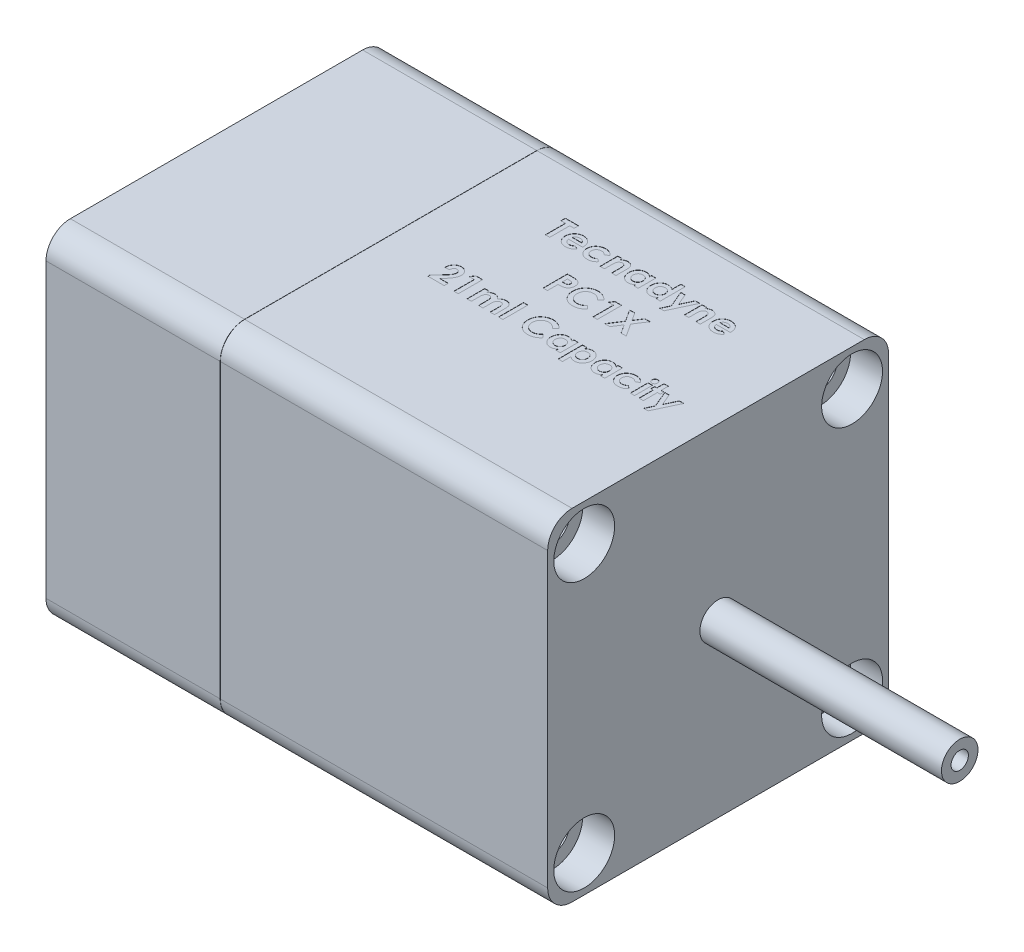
SolidWorks part; units mm, degrees
ref_plane "Front Plane" through (0, 0, 0) normal (0, 0, 1) x (1, 0, 0)
ref_plane "Top Plane" through (0, 0, 0) normal (0, 1, 0) x (1, 0, 0)
ref_plane "Right Plane" through (0, 0, 0) normal (1, 0, 0) x (0, 0, -1)
sketch "Sketch1" plane through (0, 0, 0) normal (1, 0, 0) x (0, 0, -1)
  line L1 (3.175, 0) -> (41.275, 0)
  line L2 (0, 3.175) -> (0, 41.275)
  line L3 (3.175, 44.45) -> (41.275, 44.45)
  line L4 (44.45, 3.175) -> (44.45, 41.275)
  arc A0 (3.175, 0) -> (0, 3.175) centre (3.175, 3.175) cw
  arc A1 (41.275, 0) -> (44.45, 3.175) centre (41.275, 3.175) ccw
  arc A2 (41.275, 44.45) -> (44.45, 41.275) centre (41.275, 41.275) cw
  arc A3 (0, 41.275) -> (3.175, 44.45) centre (3.175, 41.275) cw
  point P7 (0, 0)
  point P10 (44.45, 0)
  point P13 (44.45, 44.45)
  point P16 (0, 44.45)
  dimension "D3" = 3.175
  dimension "D1" = 44.45
  dimension "D2" = 44.45
extrude "Boss-Extrude1" add sketch "Sketch1" along normal blind 65.405
sketch "Sketch2" plane through (65.405, 0, 0) normal (1, 0, 0) x (0, 0, -1)
  circle A0 centre (22.225, 22.225) radius 2.3813
  dimension "D1" = 4.7625
extrude "Boss-Extrude2" add sketch "Sketch2" along normal blind 31.496
ref_plane "Plane1" through (22.733, 0, 0) normal (1, 0, 0) x (0, 0, -1)
sketch "Sketch3" plane through (22.733, 0, 0) normal (1, 0, 0) x (0, 0, -1)
  circle A0 centre (22.225, 22.225) radius 31.5178
  circle A1 centre (22.225, 22.225) radius 14.577
extrude "Cut-Extrude1" cut sketch "Sketch3" against normal blind 0.0254
sketch "Sketch4" plane through (0, 44.45, 0) normal (0, 1, 0) x (1, 0, 0)
  line L0 (29.7287, 32.3275) -> (60.0668, 32.3275) construction
  text T0 "<b>  Tecnadyne</b>  <b>       PC1X</b>  <b>21ml Capacity</b>"
extrude "Cut-Extrude2" cut sketch "Sketch4" against normal blind 0.0254
hole_wizard "3/8-24 Tapped Hole1" positions "Sketch7" profile "Sketch6" tap size "3/8-24" standard "Ansi Inch"
sketch "Sketch7" plane through (0, 0, 0) normal (-1, 0, 0) x (0, 0, 1)
  point P0 (-22.225, 22.225)
sketch "Sketch6" plane through (0, 22.225, -22.225) normal (0, 1, 0) x (0, 0, 1)
  line L0 (0, 0) -> (0, 24.8855)
  line L1 (0, 24.8855) -> (4.2164, 22.352)
  line L2 (4.2164, 22.352) -> (4.2164, 0)
  line L5 (4.2164, 0) -> (0, 0)
  line L10 (0, 24.8855) -> (-4.2164, 22.352) construction
  line L11 (0, -6.35) -> (0, 107.95) construction
  dimension "Tap Drill Dia." = 8.4328
  dimension "Tap Drill Depth" = 22.352
  dimension "Drill Angle" = 118
hole_wizard "CBORE for #8 Socket Head Cap Screw1" positions "Sketch9" profile "Sketch8" counterbore size "#8" standard "Ansi Inch"
sketch "Sketch9" plane through (65.405, 0, 0) normal (1, 0, 0) x (0, 0, -1)
  line L0 (22.225, 22.225) -> (53.3406, 22.225) construction
  line L1 (22.225, 22.225) -> (22.225, 46.2388) construction
  circle A0 centre (22.225, 22.225) radius 2.3813 construction
  point P5 (39.6875, 4.7625)
  point P19 (39.6875, 39.6875)
  point P21 (4.7625, 4.7625)
  point P22 (4.7625, 39.6875)
  dimension "D1" = 17.4625
  dimension "D2" = 17.4625
sketch "Sketch8" plane through (65.405, 4.7625, -39.6875) normal (0, 1, 0) x (0, 0, -1)
  line L0 (0, 0) -> (0, 65.405)
  line L1 (0, 65.405) -> (2.2479, 65.405)
  line L3 (2.2479, 65.405) -> (2.2479, 4.1656)
  line L4 (2.2479, 4.1656) -> (3.9688, 4.1656)
  line L5 (3.9688, 4.1656) -> (3.9687, 0)
  line L7 (3.9687, 0) -> (0, 0)
  line L11 (0, -6.35) -> (0, 107.95) construction
  dimension "Thru Hole Dia." = 4.4958
  dimension "Thru Hole Depth" = 65.405
  dimension "C'Bore Dia." = 7.9375
  dimension "C'Bore Depth" = 4.1656
sketch "Sketch11" plane through (0, 0, 0) normal (-1, 0, 0) x (0, 0, 1)
  circle A0 centre (-22.225, 22.225) radius 14.4399
  circle A1 centre (-22.225, 22.225) radius 9.8679
  dimension "D1" = 28.8798
  dimension "D2" = 19.7358
extrude "Cut-Extrude4" cut sketch "Sketch11" against normal blind 2.54
hole_wizard "#4-40 Tapped Hole1" positions "Sketch13" profile "Sketch12" tap size "#4-40" standard "Ansi Inch"
sketch "Sketch13" plane through (96.901, 0, 0) normal (1, 0, 0) x (0, 0, -1)
  point P0 (22.225, 22.225)
sketch "Sketch12" plane through (96.901, 22.225, -22.225) normal (0, 1, 0) x (0, 0, -1)
  line L0 (0, 0) -> (0, 13.6332)
  line L1 (0, 13.6332) -> (1.1303, 12.954)
  line L2 (1.1303, 12.954) -> (1.1303, 0)
  line L5 (1.1303, 0) -> (0, 0)
  line L10 (0, 13.6332) -> (-1.1303, 12.954) construction
  line L11 (0, -6.35) -> (0, 107.95) construction
  dimension "Tap Drill Dia." = 2.2606
  dimension "Tap Drill Depth" = 12.954
  dimension "Drill Angle" = 118
equation "\"Buoyancy\"=\"SW-Volume\"*(\"SW-Density\"-.037062)"
